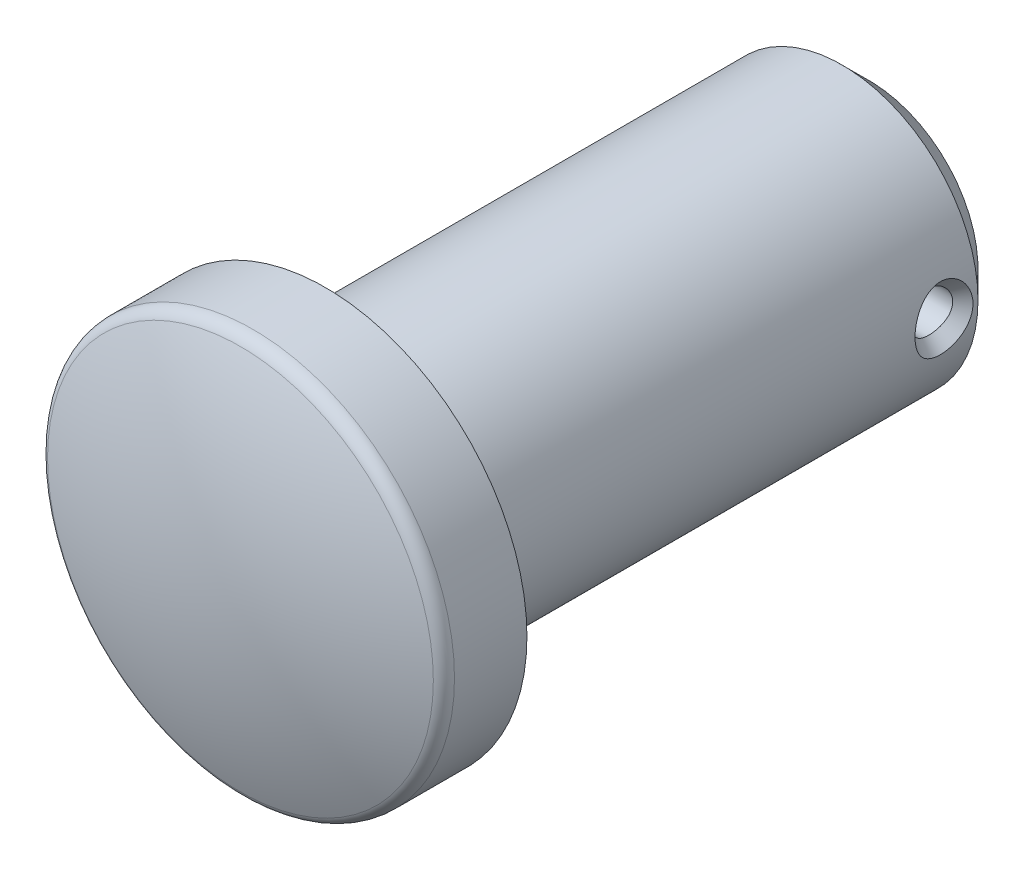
SolidWorks part; units mm, degrees
ref_plane "Plan de face" through (0, 0, 0) normal (0, 0, 1) x (1, 0, 0)
ref_plane "Plan de dessus" through (0, 0, 0) normal (0, 1, 0) x (1, 0, 0)
ref_plane "Plan de droite" through (0, 0, 0) normal (1, 0, 0) x (0, 0, -1)
sketch "Esquisse1" plane through (0, 0, 0) normal (0, 0, 1) x (1, 0, 0)
  circle A0 centre (5.8521, 294.72) radius 14.8185
extrude "Boss.-Extru.1" add sketch "Esquisse1" along normal blind 6
dome "Dôme1" faces to dome 2 distance 3 parameters "D1"=3
sketch "Esquisse2" plane through (0, 0, 0) normal (0, 0, -1) x (-1, 0, 0)
  circle A0 centre (-5.8521, 294.72) radius 10
extrude "Boss.-Extru.2" add sketch "Esquisse2" along normal blind 40
chamfer "Chanfrein1" distance 2 angle 45 1 edges at (-4.1479, 294.72, -40)
fillet "Congé1" radius 1 1 edges at (20.6706, 294.72, 6)
sketch "Esquisse3" plane through (0, 0, 0) normal (1, 0, 0) x (0, 0, -1)
  line L0 (40, 286.72) -> (40, 302.72) construction
  circle A0 centre (35.5, 294.6945) radius 1.5
  dimension "D2" = 3
  dimension "D1" = 4.5
extrude "Enlèv. mat.-Extru.1" cut sketch "Esquisse3" against normal through all and the other way through all
chamfer "Chanfrein2" distance 1 angle 45 2 edges at (15.8483, 294.9955, -34.0305) (-4.1417, 294.3685, -34.0358)
